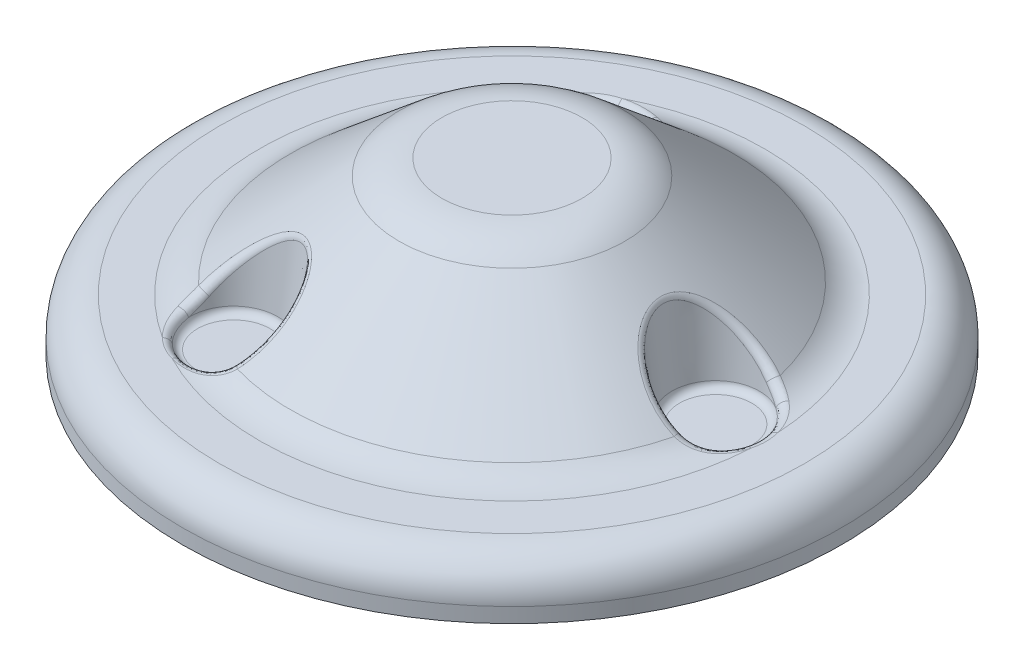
SolidWorks part; units mm, degrees
other "target"
other "tool"
ref_plane "Front Plane" through (0, 0, 0) normal (0, 0, 1) x (1, 0, 0)
ref_plane "Top Plane" through (0, 0, 0) normal (0, 1, 0) x (1, 0, 0)
ref_plane "Right Plane" through (0, 0, 0) normal (1, 0, 0) x (0, 0, -1)
sketch "Sketch1" plane through (0, 0, 0) normal (0, 0, -1) x (1, 0, 0)
  line L0 (79, 0) -> (68.2446, 0)
  line L1 (59.8708, -3.0562) -> (30.525, -27.7684)
  line L2 (18.9306, -32) -> (0, -32)
  line L3 (0, -32) -> (0, 0) construction
  line L4 (89, 10) -> (89, 14)
  arc A0 (68.2446, 0) -> (59.8708, -3.0562) centre (68.2446, -13) ccw
  arc A1 (30.525, -27.7684) -> (18.9306, -32) centre (18.9306, -14) cw
  arc A2 (79, 0) -> (89, 10) centre (79, 10) ccw
  point P10 (25.5, -32)
  point P11 (63.5, 0)
  point P15 (89, 0)
  dimension "D1" = 13
  dimension "D2" = 18
  dimension "D8" = 10
  dimension "D3" = 178
  dimension "D4" = 51
  dimension "D5" = 127
  dimension "D6" = 32
  dimension "D7" = 46
revolve "Revolve-Thin1" add sketch "Sketch1" angle 360 about L3
sketch "Sketch2" plane through (0, 0, 0) normal (0, 0, 1) x (1, 0, 0)
  line L0 (55, 27.5) -> (55, 40.281) construction
  line L1 (41, 27.5) -> (55, 27.5)
  line L2 (41, 27.5) -> (44.5, -1.5)
  line L3 (44.5, -1.5) -> (55, -1.5)
  line L4 (55, -1.5) -> (55, 27.5)
  line L5 (55, -1.5) -> (55, 27.5) construction
  line L8 (-89, -14) -> (89, -14) construction
  point P1 (49.75, -1.5)
  dimension "D1" = 28
  dimension "D2" = 21
  dimension "D3" = 55
  dimension "D4" = 12.5
  dimension "D5" = 29
revolve "Revolve1" add sketch "Sketch2" angle 360 about L0
fillet "Fillet1" radius 0.8 1 edges at (65.5, -1.5, 0)
pattern_circular "CirPattern1" count 3 over 360 about axis through (0, 0, 0) along (0, 1, 0)
other "Indent1" parameters "D1"=6, "D2"=1.25
fillet "Fillet2" radius 2 6 edges at (-21.6842, 19.0648, -34.632) (-31.9338, 0.0752, -58.7275) (40.7477, 19.1597, 0.0807) (66.9404, 0.0654, 0.4265) (-19.1501, 19.0648, 36.0951) (-34.8926, 0.0752, 57.0192)
delete or keep bodies "Body-Delete/Keep 1" type keep bodies bodies 105
